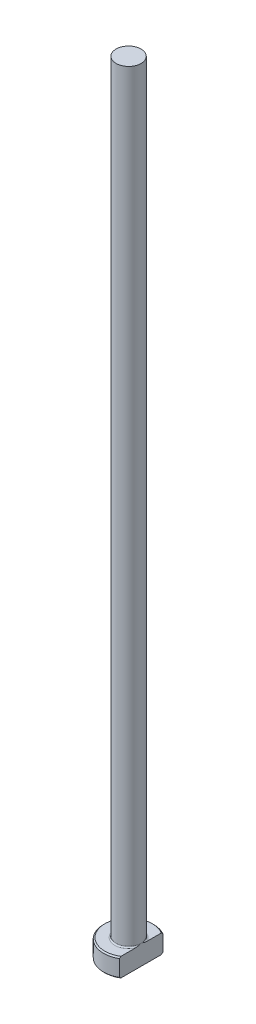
SolidWorks part; units mm, degrees
ref_plane "Front Plane" through (0, 0, 0) normal (0, 0, 1) x (1, 0, 0)
ref_plane "Top Plane" through (0, 0, 0) normal (0, 1, 0) x (1, 0, 0)
ref_plane "Right Plane" through (0, 0, 0) normal (1, 0, 0) x (0, 0, -1)
sketch "Sketch1" plane through (0, 0, 0) normal (0, 0, 1) x (1, 0, 0)
  line L0 (0, 259.9588) -> (0, -15.1925) construction
  line L1 (0, 0) -> (-4, 0)
  line L2 (-4, 0) -> (-4, 3)
  line L3 (-4, 3) -> (-2, 3)
  line L4 (-2, 3) -> (-2, 125)
  line L5 (-2, 125) -> (0, 125)
  line L6 (0, 125) -> (0, 0)
  dimension "L" = 125
  dimension "H" = 8
  dimension "T" = 3
  dimension "D" = 4
revolve "Revolve1" add sketch "Sketch1" angle 360 about L0
chamfer "Chamfer1" distance 0.2 angle 45 2 edges at (0, 3, 4) (0, 0, 4)
fillet "Fillet1" radius 0.2 1 edges at (0, 3, 2)
sketch "Sketch2" plane through (0, 0, 0) normal (0, 1, 0) x (1, 0, 0)
  line L0 (2, 3.4641) -> (2, -3.4641)
  circle A0 centre (0, 0) radius 4 construction
  arc A1 (2, -3.4641) -> (2, 3.4641) centre (0, 0) ccw
  circle A2 centre (0, 0) radius 2 construction
extrude "KEY" cut sketch "Sketch2" along normal through all
